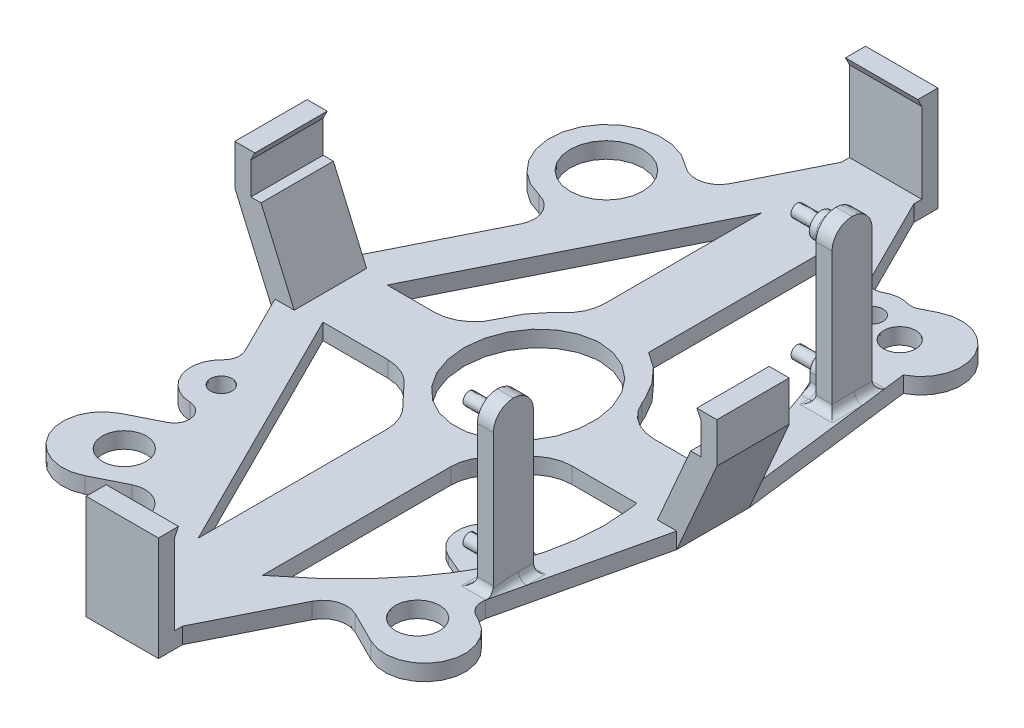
SolidWorks part; units mm, degrees
other "<ARD_mid>-<Fillet11>"
ref_plane "Front Plane" through (0, 0, 0) normal (0, 0, 1) x (1, 0, 0)
ref_plane "Top Plane" through (0, 0, 0) normal (0, 1, 0) x (1, 0, 0)
ref_plane "Right Plane" through (0, 0, 0) normal (1, 0, 0) x (0, 0, -1)
mirrored part "ARD_mid_Mirrored"
